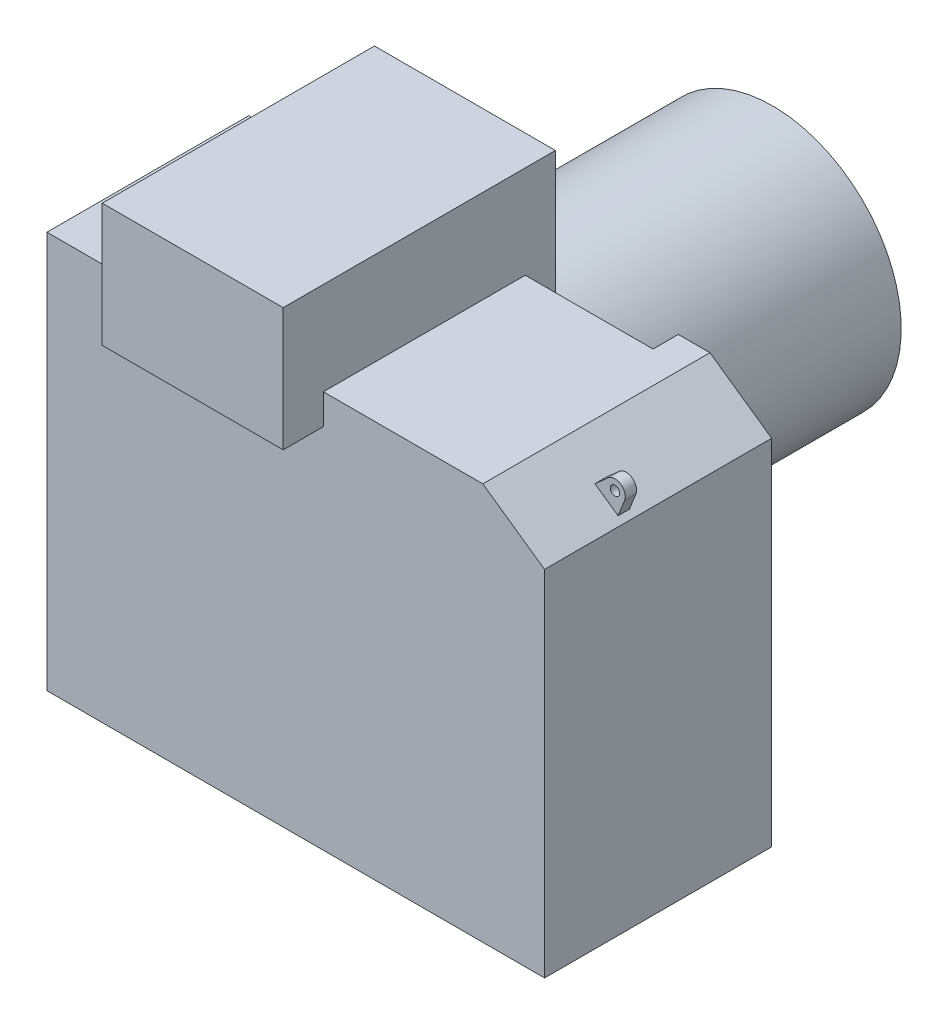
SolidWorks part; units mm, degrees
ref_plane "Front" through (0, 0, 0) normal (0, 0, 1) x (1, 0, 0)
ref_plane "Top" through (0, 0, 0) normal (0, 1, 0) x (1, 0, 0)
ref_plane "Right" through (0, 0, 0) normal (1, 0, 0) x (0, 0, -1)
sketch "Sketch1" plane through (0, 0, 0) normal (0, 1, 0) x (1, 0, 0)
  line L0 (-58.7375, -38.1) -> (-58.7375, 34.1313)
  line L1 (-58.7375, 34.1313) -> (39.0502, 34.1313)
  line L2 (68.9398, 33.6326) -> (98.425, 33.6326)
  line L3 (98.425, 33.6326) -> (98.425, -38.1)
  line L4 (98.425, -38.1) -> (-58.7375, -38.1)
  line L5 (50.8056, 27.3522) -> (39.0502, 34.1313)
  arc A0 (50.8056, 27.3522) -> (68.9398, 33.6326) centre (57.15, 38.354) ccw
  dimension "D2" = 12.7
  dimension "D1" = 41.275
  dimension "D3" = 38.1
  dimension "D4" = 34.1313
  dimension "D5" = 58.7375
  dimension "D6" = 98.425
  dimension "D7" = 63.754
extrude "Extrude1" add sketch "Sketch1" along normal blind 26.9875
hole_wizard "1/4-20 Tapped Hole1" positions "Sketch3" profile "Sketch2" tap size "1/4-20" standard "Ansi Inch"
sketch "Sketch3" plane through (0, 0, 0) normal (0, -1, 0) x (1, 0, 0)
  point P0 (0, 0)
sketch "Sketch2" plane through (0, 0, 0) normal (1, 0, 0) x (0, 0, -1)
  line L0 (0, 0) -> (0, 8.1378)
  line L1 (0, 8.1378) -> (2.5527, 6.604)
  line L2 (2.5527, 6.604) -> (2.5527, 0)
  line L5 (2.5527, 0) -> (0, 0)
  line L10 (0, 8.1378) -> (-2.5527, 6.604) construction
  line L11 (0, -6.35) -> (0, 107.95) construction
  dimension "Tap Drill Dia." = 5.1054
  dimension "Tap Drill Depth" = 6.604
  dimension "Drill Angle" = 118
sketch "Sketch4" plane through (0, 26.9875, 0) normal (0, 1, 0) x (1, 0, 0)
  line L0 (-58.7375, 25.654) -> (68.9398, 25.654)
  line L1 (-58.7375, 34.1313) -> (-58.7375, -38.1) construction
  line L2 (68.9398, 33.6326) -> (68.9398, 25.654)
  line L3 (-58.7375, -38.1) -> (98.425, -38.1) construction
  line L4 (-58.7375, 25.654) -> (-58.7375, -38.1)
  line L5 (-58.7375, -38.1) -> (98.425, -38.1)
  line L6 (98.425, -38.1) -> (98.425, 33.6326) construction
  line L7 (98.425, -38.1) -> (98.425, 33.6326)
  line L8 (98.425, 33.6326) -> (68.9398, 33.6326) construction
  line L9 (98.425, 33.6326) -> (68.9398, 33.6326)
  dimension "D1" = 63.754
extrude "Extrude2" add sketch "Sketch4" along normal blind 88.9
sketch "Sketch5" plane through (0, 115.8875, 0) normal (0, 1, 0) x (1, 0, 0)
  line L0 (-28.575, 25.654) -> (-28.575, 35.179)
  line L1 (68.9398, 25.654) -> (-58.7375, 25.654) construction
  line L2 (-28.575, 35.179) -> (28.575, 35.179)
  line L3 (28.575, 35.179) -> (28.575, 25.654)
  line L4 (-28.575, 25.654) -> (-58.7375, 25.654)
  line L5 (28.575, -38.1) -> (28.575, -50.8)
  line L6 (28.575, -50.8) -> (-28.575, -50.8)
  line L7 (-28.575, -50.8) -> (-28.575, -38.1)
  line L8 (28.575, -38.1) -> (98.425, -38.1)
  line L10 (-58.7375, 25.654) -> (-58.7375, -38.1)
  line L11 (-58.7375, -38.1) -> (98.425, -38.1)
  line L12 (98.425, -38.1) -> (98.425, 33.6326)
  line L13 (98.425, 33.6326) -> (68.9398, 33.6326)
  line L14 (68.9398, 33.6326) -> (68.9398, 25.654)
  line L15 (68.9398, 25.654) -> (-58.7375, 25.654)
  line L16 (-58.7375, 25.654) -> (-58.7375, -38.1)
  line L17 (-58.7375, -38.1) -> (-28.575, -38.1)
  line L18 (98.425, -38.1) -> (98.425, 33.6326)
  line L19 (98.425, 33.6326) -> (68.9398, 33.6326)
  line L20 (68.9398, 33.6326) -> (68.9398, 25.654)
  line L21 (68.9398, 25.654) -> (28.575, 25.654)
  dimension "D2" = 9.525
  dimension "D3" = 28.575
  dimension "D4" = 28.575
  dimension "D5" = 12.7
  dimension "D1" = 0
extrude "Extrude3" add sketch "Sketch5" along normal blind 9.525
sketch "Sketch6" plane through (0, 125.4125, 0) normal (0, 1, 0) x (1, 0, 0)
  line L0 (28.575, 25.654) -> (28.575, 35.179) construction
  line L1 (-28.575, 35.179) -> (-28.575, 25.654) construction
  line L2 (28.575, 35.179) -> (-28.575, 35.179) construction
  line L3 (28.575, -38.1) -> (28.575, 35.179)
  line L4 (-28.575, 35.179) -> (-28.575, -38.1)
  line L5 (28.575, 35.179) -> (-28.575, 35.179)
  line L7 (-28.575, -50.8) -> (28.575, -50.8) construction
  line L8 (-28.575, -38.1) -> (-28.575, -50.8) construction
  line L9 (28.575, -50.8) -> (28.575, -38.1) construction
  line L10 (-28.575, -50.8) -> (28.575, -50.8)
  line L11 (-28.575, -38.1) -> (-28.575, -50.8)
  line L12 (28.575, -50.8) -> (28.575, -38.1)
extrude "Extrude4" add sketch "Sketch6" along normal blind 29.3687
sketch "Sketch7" plane through (0, 0, -25.654) normal (0, 0, -1) x (-1, 0, 0)
  circle A0 centre (0, 63.5) radius 32.258
  dimension "D2" = 64.516
  dimension "D1" = 63.5
extrude "28mm Lens" add sketch "Sketch7" along normal blind 50.8
ref_plane "Focal Plane" [suppressed] through (0, 0, -43.434) normal (0, 0, -1) x (-1, 0, 0)
ref_plane "LensPosition" through (0, 63.5, 0) normal (0, 1, 0) x (-1, 0, 0)
ref_plane "LugPlane" through (0, 0, 7.9375) normal (0, 0, 1) x (1, 0, 0)
sketch "Sketch8" plane through (0, 0, 7.9375) normal (0, 0, 1) x (1, 0, 0)
  line L0 (-66.2369, 117.3548) -> (-58.7375, 120.1765)
  line L1 (-66.2369, 111.2452) -> (-58.7375, 108.4235)
  line L2 (-58.7375, 125.4125) -> (-58.7375, 0) construction
  line L3 (-58.7375, 120.1765) -> (-58.7375, 108.4235)
  circle A0 centre (-65.0875, 114.3) radius 1.4859
  arc A1 (-66.2369, 117.3548) -> (-66.2369, 111.2452) centre (-65.0875, 114.3) ccw
  point P7 (-58.7375, 114.3)
  dimension "D3" = 2.9718
  dimension "D4" = 1.778
  dimension "D1" = 65.0875
  dimension "D2" = 114.3
extrude "Extrude6" add sketch "Sketch8" along normal blind 3.556
sketch "Sketch10" plane through (0, 0, 0) normal (0, 0, 1) x (1, 0, 0)
  line L0 (69.0225, 132.3479) -> (127.8275, 91.1721)
  line L1 (127.8275, 91.1721) -> (127.8275, 127.3819)
  line L2 (127.8275, 127.3819) -> (69.0225, 132.3479)
  line L3 (98.425, 125.4125) -> (98.425, 0) construction
  line L4 (98.425, 125.4125) -> (98.425, 0) construction
  point P5 (98.425, 111.76)
  dimension "D1" = 55
  dimension "D2" = 111.76
extrude "Extrude7" cut sketch "Sketch10" against normal through all and the other way through all
ref_plane "LugPlane2" through (0, 0, 9.525) normal (0, 0, 1) x (1, 0, 0)
ref_plane "Entrance Pupil" through (0, 0, -54.864) normal (0, 0, -1) x (-1, 0, 0)
sketch "Sketch9" plane through (0, 0, 9.525) normal (0, 0, 1) x (1, 0, 0)
  line L0 (98.8219, 142.1993) -> (98.8219, -18.468) construction
  line L1 (98.425, 111.76) -> (78.9272, 125.4125) construction
  line L2 (96.6243, 113.0209) -> (89.323, 118.1333)
  line L3 (98.6797, 118.1886) -> (96.6243, 113.0209)
  line L4 (93.4761, 121.8322) -> (89.323, 118.1333)
  line L5 (92.9736, 115.5771) -> (95.6469, 119.3949) construction
  circle A0 centre (95.6469, 119.3949) radius 1.4859
  arc A1 (98.6797, 118.1886) -> (93.4761, 121.8322) centre (95.6469, 119.3949) ccw
  dimension "D1" = 2.9718
  dimension "D2" = 1.778
  dimension "D5" = 3.175
  dimension "D3" = 98.8219
  dimension "D4" = 119.3949
extrude "Extrude8" add sketch "Sketch9" along normal blind 3.556
sketch "Sketch11" plane through (0, 0, -54.864) normal (0, 0, -1) x (-1, 0, 0)
  line L0 (17.907, 51.5112) -> (-17.907, 75.4888) construction
  line L1 (-17.907, 75.4888) -> (17.907, 75.4888)
  line L2 (-17.907, 75.4888) -> (-17.907, 51.5112)
  line L3 (-17.907, 51.5112) -> (17.907, 51.5112)
  line L4 (17.907, 75.4888) -> (17.907, 51.5112)
  circle A0 centre (0, 63.5) radius 32.258 construction
  circle A1 centre (0, 63.5) radius 32.258 construction
  dimension "D1" = 35.814
  dimension "D2" = 23.9776
ref_plane "FOV_Plane1" through (0, 0, -3073.654) normal (0, 0, -1) x (-1, 0, 0)
sketch "Sketch12" plane through (0, 0, -3073.654) normal (0, 0, -1) x (-1, 0, 0)
  line L0 (3149.6, -2070.1) -> (-3149.6, 2197.1) construction
  line L1 (-3149.6, 2197.1) -> (3149.6, 2197.1)
  line L2 (-3149.6, 2197.1) -> (-3149.6, -2070.1)
  line L3 (-3149.6, -2070.1) -> (3149.6, -2070.1)
  line L4 (3149.6, 2197.1) -> (3149.6, -2070.1)
  circle A0 centre (0, 63.5) radius 32.258 construction
  circle A1 centre (0, 63.5) radius 32.258 construction
  dimension "D1" = 6299.2
  dimension "D2" = 4267.2
loft "28mm FOV_Loft1" [suppressed] add profiles "Sketch11", "Sketch12"
sketch "Sketch14" plane through (0, 0, -25.654) normal (0, 0, -1) x (-1, 0, 0)
  line L0 (-39.0502, 0) -> (58.7375, 0) construction
  circle A0 centre (0, 63.5) radius 40.64
  dimension "D1" = 63.5
extrude "17-35 lens" add sketch "Sketch14" along normal blind 106.68
fillet "Fillet3" [suppressed] radius 2.54
sketch "Sketch15" plane through (0, 0, 0) normal (0, 0, 1) x (1, 0, 0)
  line L0 (17.907, 51.5112) -> (-17.907, 75.4888) construction
  line L1 (-17.907, 75.4888) -> (17.907, 75.4888)
  line L2 (-17.907, 75.4888) -> (-17.907, 51.5112)
  line L3 (-17.907, 51.5112) -> (17.907, 51.5112)
  line L4 (17.907, 75.4888) -> (17.907, 51.5112)
  circle A1 centre (0, 63.5) radius 32.258 construction
  dimension "D1" = 35.814
  dimension "D2" = 23.9776
sketch "Sketch16" plane through (0, 0, -3073.654) normal (0, 0, -1) x (-1, 0, 0)
  line L0 (50, 63.5) -> (-50, 63.5) construction
  line L1 (-2565.4, 1765.3) -> (2565.4, 1765.3)
  line L2 (-2565.4, 1765.3) -> (-2565.4, -1638.3)
  line L3 (-2565.4, -1638.3) -> (2565.4, -1638.3)
  line L4 (2565.4, 1765.3) -> (2565.4, -1638.3)
  line L5 (0, 50) -> (0, -50) construction
  dimension "D1" = 5130.8
  dimension "D2" = 3403.6
  dimension "D3" = 1701.8
  dimension "D4" = 2565.4
loft "35mm FOV" [suppressed] add profiles "Sketch16", "Sketch15"
sketch "Sketch17" [suppressed] plane through (0, 0, 0) normal (0, 0, 1) x (1, 0, 0)
  line L0 (17.907, 51.5112) -> (-17.907, 75.4888) construction
  line L1 (-17.907, 75.4888) -> (17.907, 75.4888)
  line L2 (-17.907, 75.4888) -> (-17.907, 51.5112)
  line L3 (-17.907, 51.5112) -> (17.907, 51.5112)
  line L4 (17.907, 75.4888) -> (17.907, 51.5112)
  circle A1 centre (0, 63.5) radius 32.258 construction
  dimension "D1" = 35.814
  dimension "D2" = 23.9776
sketch "Sketch18" [suppressed] plane through (0, 0, -3073.654) normal (0, 0, -1) x (-1, 0, 0)
  line L1 (-4229.1, 2781.3) -> (4229.1, 2781.3)
  line L2 (-4229.1, 2781.3) -> (-4229.1, -2654.3)
  line L3 (-4229.1, -2654.3) -> (4229.1, -2654.3)
  line L4 (4229.1, 2781.3) -> (4229.1, -2654.3)
  circle A0 centre (0, 63.5) radius 40.64 construction
  arc A1 (17.8451, 26.9875) -> (-17.8451, 26.9875) centre (0, 63.5) ccw construction
  dimension "D4" = 4229.1
  dimension "D1" = 8458.2
  dimension "D2" = 5435.6
  dimension "D3" = 2717.8
loft "22mm FOV" [suppressed] add profiles "Sketch18", "Sketch17"
ref_plane "Min focus plane" [suppressed] through (0, 0, -508) normal (0, 0, 1) x (1, 0, 0)
sketch "Sketch19" [suppressed] plane through (0, 0, -508) normal (0, 0, 1) x (1, 0, 0)
  line L1 (-4432.943, 3165.7536) -> (5497.4945, 3165.7536)
  line L2 (-4432.943, 3165.7536) -> (-4432.943, -3157.0371)
  line L3 (-4432.943, -3157.0371) -> (5497.4945, -3157.0371)
  line L4 (5497.4945, 3165.7536) -> (5497.4945, -3157.0371)
extrude "Cut-Extrude1" [suppressed] cut sketch "Sketch19" along normal through all
